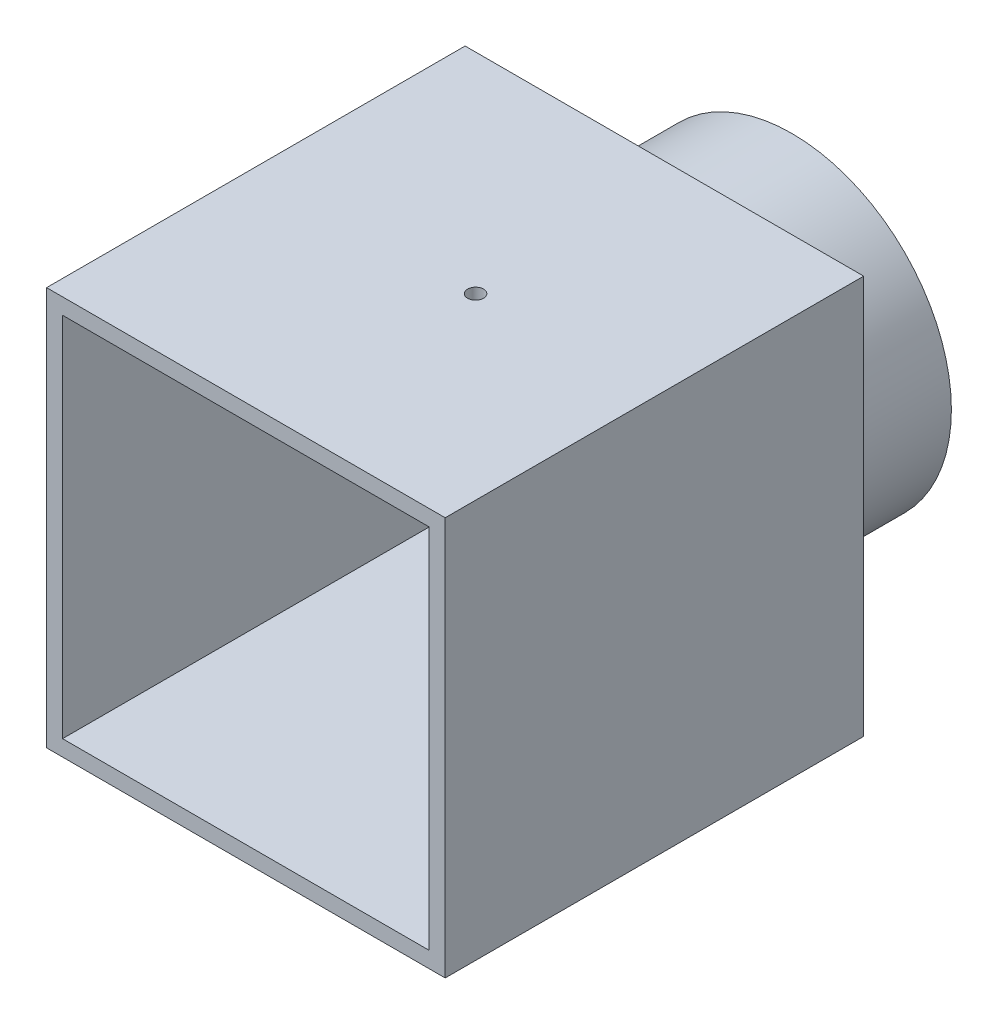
SolidWorks part; units mm, degrees
ref_plane "Plan de face" through (0, 0, 0) normal (0, 0, 1) x (1, 0, 0)
ref_plane "Plan de dessus" through (0, 0, 0) normal (0, 1, 0) x (1, 0, 0)
ref_plane "Plan de droite" through (0, 0, 0) normal (1, 0, 0) x (0, 0, -1)
sketch "Esquisse2" plane through (0, 0, 0) normal (0, 0, 1) x (1, 0, 0)
  line L1 (-50, 50) -> (50, 50)
  line L2 (-50, 50) -> (-50, -50)
  line L3 (-50, -50) -> (50, -50)
  line L4 (50, 50) -> (50, -50)
  line L5 (-50, 50) -> (50, -50) construction
  line L6 (-50, -50) -> (50, 50) construction
  line L11 (-45.3596, 45.3596) -> (45.3596, -45.3596) construction
  line L12 (-45.3596, -45.3596) -> (45.3596, 45.3596) construction
  line L13 (-46, 46) -> (46, 46)
  line L14 (-46, 46) -> (-46, -46)
  line L15 (-46, -46) -> (46, -46)
  line L16 (46, 46) -> (46, -46)
  line L17 (-46, 46) -> (46, -46) construction
  line L18 (-46, -46) -> (46, 46) construction
  point P0 (0, 0)
  point P6 (0, 0)
  point P12 (0, 0)
  dimension "D1" = 100
  dimension "D2" = 100
  dimension "D3" = 92
  dimension "D4" = 92
extrude "Boss.-Extru.1" add sketch "Esquisse2" along normal blind 105
sketch "Esquisse3" plane through (0, 0, 0) normal (0, 0, -1) x (-1, 0, 0)
  line L1 (-46, 46) -> (46, 46)
  line L2 (-46, 46) -> (-46, -46)
  line L3 (-46, -46) -> (46, -46)
  line L4 (46, 46) -> (46, -46)
  line L5 (-46, 46) -> (46, -46) construction
  line L6 (-46, -46) -> (46, 46) construction
  point P0 (0, 0)
extrude "Boss.-Extru.2" add sketch "Esquisse3" against normal blind 4
sketch "Esquisse4" plane through (0, 0, 0) normal (0, 0, -1) x (-1, 0, 0)
  circle A0 centre (0, 0) radius 40
  circle A1 centre (0, 0) radius 36
extrude "Boss.-Extru.3" add sketch "Esquisse4" along normal blind 32
sketch "Esquisse5" plane through (0, 50, 0) normal (0, 1, 0) x (1, 0, 0)
  circle A1 centre (5.1155, -52.5) radius 2
extrude "Enlèv. mat.-Extru.1" cut sketch "Esquisse5" against normal blind 10
